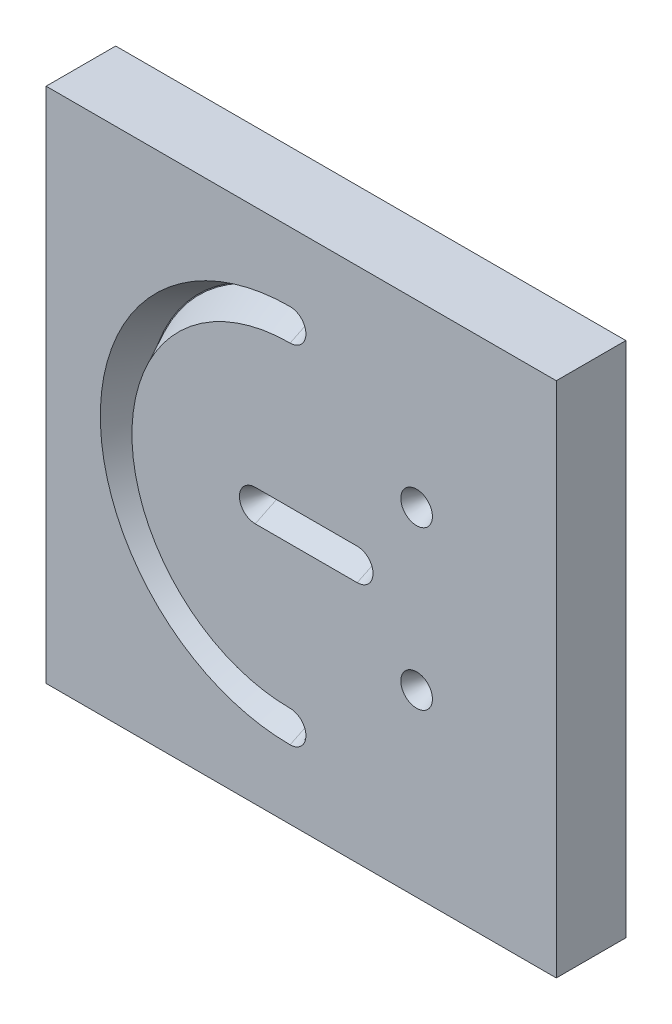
SolidWorks part; units mm, degrees
ref_plane "Ebene vorne" through (0, 0, 0) normal (0, 0, 1) x (1, 0, 0)
ref_plane "Ebene oben" through (0, 0, 0) normal (0, 1, 0) x (1, 0, 0)
ref_plane "Ebene rechts" through (0, 0, 0) normal (1, 0, 0) x (0, 0, -1)
sketch "Skizze1" plane through (0, 0, 0) normal (0, 0, 1) x (1, 0, 0)
  line L1 (0, 0) -> (80.6458, 0)
  line L2 (0, 0) -> (0, 81.7718)
  line L3 (0, 81.7718) -> (80.6458, 81.7718)
  line L4 (80.6458, 0) -> (80.6458, 81.7718)
extrude "Linear austragen1" add sketch "Skizze1" along normal blind 11
sketch "Skizze2" plane through (0, 0, 11) normal (0, 0, 1) x (1, 0, 0)
  line L0 (38.5671, 81.7718) -> (38.5671, 0) construction
  line L1 (80.6458, 81.7718) -> (0, 81.7718) construction
  line L2 (0, 0) -> (80.6458, 0) construction
  line L3 (80.6458, 40.8859) -> (-3.7552, 40.8859) construction
  line L4 (80.6458, 0) -> (80.6458, 81.7718) construction
  line L5 (58.5671, 53.3859) -> (58.5671, 28.3859) construction
  line L7 (49.1783, 43.3859) -> (33.0552, 43.3859)
  line L9 (49.1783, 38.3859) -> (33.0552, 38.3859)
  arc A0 (38.5671, 65.8859) -> (38.5671, 15.8859) centre (38.5671, 40.8859) ccw
  arc A1 (38.5671, 70.8859) -> (38.5671, 10.8859) centre (38.5671, 40.8859) ccw
  arc A2 (41.0645, 68.2723) -> (41.0645, 13.4995) centre (38.5671, 40.8859) ccw construction
  arc A3 (38.5671, 65.8859) -> (38.5671, 70.8859) centre (38.5671, 68.3859) ccw
  arc A4 (38.5671, 10.8859) -> (38.5671, 15.8859) centre (38.5671, 13.3859) ccw
  circle A5 centre (58.5671, 53.3859) radius 2.5
  circle A6 centre (58.5671, 28.3859) radius 2.5
  arc A7 (49.1783, 38.3859) -> (49.1783, 43.3859) centre (49.1783, 40.8859) ccw
  arc A8 (33.0552, 43.3859) -> (33.0552, 38.3859) centre (33.0552, 40.8859) ccw
  dimension "D1" = 50
  dimension "D2" = 60
  dimension "D3" = 55
  dimension "D4" = 5
  dimension "D5" = 5
  dimension "D6" = 20
  dimension "D7" = 12.5
  dimension "D8" = 25
  dimension "D9" = 5
  dimension "D10" = 2.5
extrude "Schnitt-Linear austragen2" cut sketch "Skizze2" against normal blind 5 draft 26
